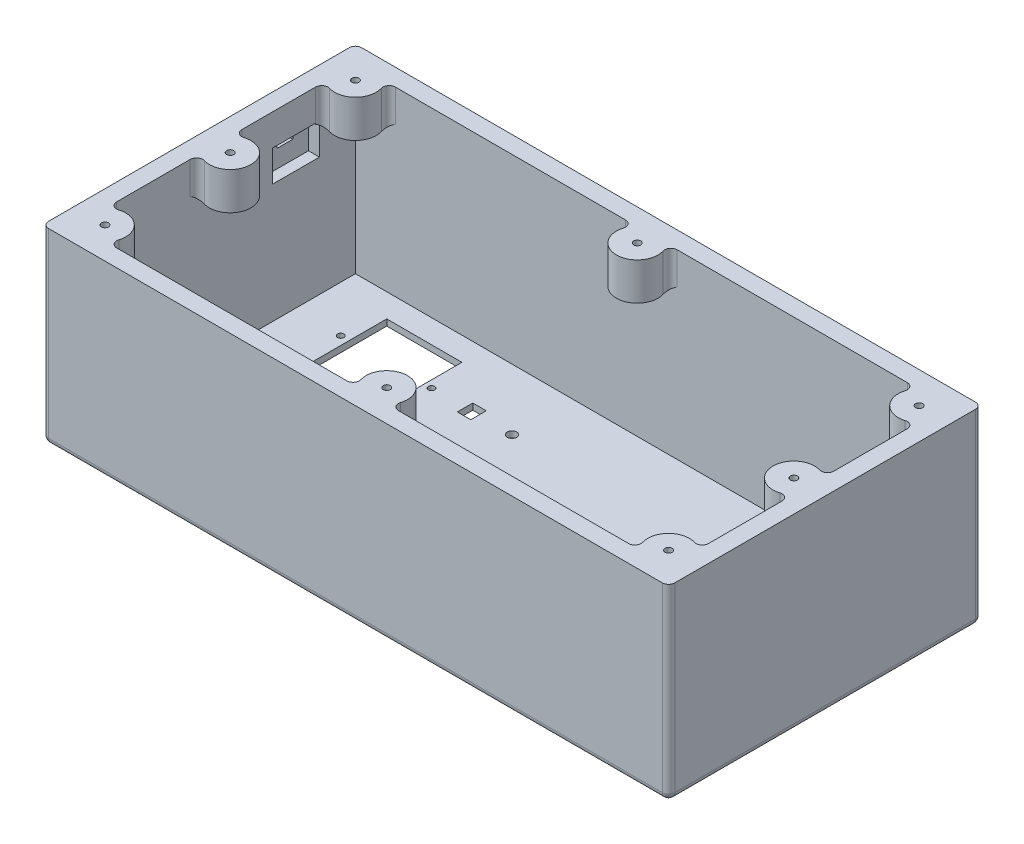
SolidWorks part; units mm, degrees
ref_plane "Front Plane" through (0, 0, 0) normal (0, 0, 1) x (1, 0, 0)
ref_plane "Top Plane" through (0, 0, 0) normal (0, 1, 0) x (1, 0, 0)
ref_plane "Right Plane" through (0, 0, 0) normal (1, 0, 0) x (0, 0, -1)
sketch "Sketch1" plane through (0, 0, 0) normal (0, 1, 0) x (1, 0, 0)
  line L1 (-100, 50) -> (100, 50)
  line L2 (-100, 50) -> (-100, -50)
  line L3 (-100, -50) -> (100, -50)
  line L4 (100, 50) -> (100, -50)
  line L5 (-100, 50) -> (100, -50) construction
  line L6 (-100, -50) -> (100, 50) construction
  point P0 (0, 0)
  dimension "D1" = 200
  dimension "D2" = 100
extrude "Boss-Extrude1" add sketch "Sketch1" along normal blind 60
sketch "Sketch2" plane through (0, 60, 0) normal (0, 1, 0) x (1, 0, 0)
  line L0 (100, 50) -> (-100, 50) construction
  line L1 (-100, 50) -> (-100, -50) construction
  line L2 (100, -50) -> (100, 50) construction
  line L3 (-100, -50) -> (100, -50) construction
  point P0 (-90, 40)
  point P1 (-90, 0)
  point P2 (-90, -40)
  point P3 (0, 40)
  point P4 (90, 40)
  point P5 (90, 0)
  point P6 (90, -40)
  point P7 (0, -40)
hole_wizard "#4-40 Tapped Hole1" positions "Sketch3" profile "Sketch4" tap size "#4-40" standard "ANSI Inch"
sketch "Sketch3" plane through (0, 60, 0) normal (0, 1, 0) x (1, 0, 0)
  point P0 (-90, 40)
  point P4 (-90, 0)
  point P7 (-90, -40)
  point P10 (0, -40)
  point P13 (90, -40)
  point P16 (90, 0)
  point P19 (90, 40)
  point P22 (0, 40)
sketch "Sketch4" plane through (-90, 60, -40) normal (1, 0, 0) x (0, 0, 1)
  line L0 (0, 0) -> (0, 9.5492)
  line L1 (0, 9.5492) -> (1.1303, 8.87)
  line L2 (1.1303, 8.87) -> (1.1303, 0)
  line L5 (1.1303, 0) -> (0, 0)
  line L10 (0, 9.5492) -> (-1.1303, 8.87) construction
  line L11 (0, -6.35) -> (0, 107.95) construction
  dimension "Tap Drill Dia." = 2.2606
  dimension "Tap Drill Depth" = 8.87
  dimension "Drill Angle" = 118
shell "Shell5" thickness 5.5
fillet "Fillet2" radius 2 16 edges at (94.5, 54.0091, -35.1306) (85.1306, 54.0091, -44.5) (4.8694, 54.0091, -44.5) (-4.8694, 54.0091, -44.5) (-85.1306, 54.0091, -44.5) (-94.5, 54.0091, -35.1306) (-94.5, 54.0091, -4.8694) (-94.5, 54.0091, 4.8694) (-94.5, 54.0091, 35.1306) (-85.1306, 54.0091, 44.5) (-4.8694, 54.0091, 44.5) (4.8694, 54.0091, 44.5) (85.1306, 54.0091, 44.5) (94.5, 54.0091, 35.1306) (94.5, 54.0091, 4.8694) (94.5, 54.0091, -4.8694)
sketch "Sketch5" plane through (0, 0, 0) normal (0, -1, 0) x (1, 0, 0)
  line L0 (-100, -50) -> (-100, 50) construction
  line L1 (100, -50) -> (-100, -50) construction
  circle A0 centre (-79.7, -25) radius 1
  dimension "D3" = 2
  dimension "D1" = 20.3
  dimension "D2" = 25
extrude "Cut-Extrude1" cut sketch "Sketch5" against normal blind 5 contours A0
sketch "Sketch6" plane through (0, 0, 0) normal (0, -1, 0) x (1, 0, 0)
  line L0 (100, -50) -> (-100, -50) construction
  line L1 (-77, -13) -> (-53, -13)
  line L2 (-77, -13) -> (-77, -37)
  line L3 (-77, -37) -> (-53, -37)
  line L4 (-53, -13) -> (-53, -37)
  line L5 (-77, -13) -> (-53, -37) construction
  line L6 (-77, -37) -> (-53, -13) construction
  line L7 (-100, -50) -> (-100, 50) construction
  point P0 (-65, -25)
  dimension "D1" = 24
  dimension "D2" = 24
  dimension "D3" = 25
  dimension "D4" = 23
extrude "Cut-Extrude3" cut sketch "Sketch6" against normal blind 5 contours L2 L1 L4 L3
sketch "Sketch7" plane through (0, 0, 0) normal (0, -1, 0) x (1, 0, 0)
  line L0 (-100, -50) -> (-100, 50) construction
  line L1 (100, -50) -> (-100, -50) construction
  circle A0 centre (-50.7, -25) radius 1
  dimension "D3" = 2
  dimension "D1" = 49.3
  dimension "D2" = 25
extrude "Cut-Extrude4" cut sketch "Sketch7" against normal blind 5 contours A0
sketch "Sketch8" plane through (0, 0, 0) normal (0, -1, 0) x (1, 0, 0)
  line L1 (-40, -22.525) -> (-35.7, -22.525)
  line L2 (-40, -22.525) -> (-40, -27.475)
  line L3 (-40, -27.475) -> (-35.7, -27.475)
  line L4 (-35.7, -22.525) -> (-35.7, -27.475)
  line L5 (-40, -22.525) -> (-35.7, -27.475) construction
  line L6 (-40, -27.475) -> (-35.7, -22.525) construction
  line L7 (-100, -50) -> (-100, 50) construction
  line L8 (100, -50) -> (-100, -50) construction
  point P0 (-37.85, -25)
  point P7 (-40, -25)
  point P10 (-100, 0)
  dimension "D1" = 4.3
  dimension "D2" = 4.95
  dimension "D3" = 60
  dimension "D4" = 25
extrude "Cut-Extrude5" cut sketch "Sketch8" against normal blind 5 contours L2 L1 L4 L3
sketch "Sketch9" plane through (0, 0, 0) normal (0, -1, 0) x (1, 0, 0)
  line L0 (-100, -50) -> (-100, 50) construction
  line L1 (100, -50) -> (-100, -50) construction
  circle A0 centre (-25, -25) radius 1.5
  dimension "D3" = 3
  dimension "D1" = 75
  dimension "D2" = 25
extrude "Cut-Extrude6" cut sketch "Sketch9" against normal blind 5 contours A0
sketch "Sketch10" plane through (-100, 0, 0) normal (-1, 0, 0) x (0, 0, 1)
  line L0 (-50, 60) -> (-50, 0) construction
  line L1 (-28, 50) -> (-23, 50)
  line L2 (-28, 50) -> (-28, 45.7)
  line L3 (-28, 45.7) -> (-23, 45.7)
  line L4 (-23, 50) -> (-23, 45.7)
  line L5 (-28, 50) -> (-23, 45.7) construction
  line L6 (-28, 45.7) -> (-23, 50) construction
  line L7 (-50, 60) -> (50, 60) construction
  point P0 (-25.5, 47.85)
  point P5 (-28, 47.85)
  dimension "D1" = 5
  dimension "D2" = 4.3
  dimension "D3" = 22
  dimension "D4" = 10
extrude "Cut-Extrude7" cut sketch "Sketch10" against normal blind 2
sketch "Sketch11" plane through (-94.5, 0, 0) normal (1, 0, 0) x (0, 0, -1)
  line L0 (-50, 60) -> (50, 60) construction
  line L1 (18, 50) -> (33, 50)
  line L2 (18, 50) -> (18, 40)
  line L3 (18, 40) -> (33, 40)
  line L4 (33, 50) -> (33, 40)
  line L5 (18, 50) -> (33, 40) construction
  line L6 (18, 40) -> (33, 50) construction
  line L7 (50, 60) -> (50, 0) construction
  point P0 (25.5, 45)
  dimension "D1" = 15
  dimension "D2" = 10
  dimension "D3" = 10
  dimension "D4" = 17
extrude "Cut-Extrude8" cut sketch "Sketch11" against normal blind 3.5
sketch "Sketch13" plane through (0, 0, 0) normal (0, -1, 0) x (1, 0, 0)
  line L0 (100, 50) -> (100, -50) construction
  circle A0 centre (60, 0) radius 5
  dimension "D1" = 10
  dimension "D2" = 40
extrude "Cut-Extrude9" cut sketch "Sketch13" against normal blind 5 contours A0
sketch "Sketch15" plane through (0, 0, 0) normal (0, -1, 0) x (1, 0, 0)
  line L0 (100, 50) -> (100, -50) construction
  point P0 (72.5, 0)
  point P1 (47.5, 0)
  point P4 (100, 0)
  dimension "D1" = 25
  dimension "D2" = 27.5
hole_wizard "Ø2.0mm Dowel Hole1" positions "Sketch16" profile "Sketch17" hole size "Ø2.0" standard "ANSI Metric"
sketch "Sketch16" plane through (0, 0, 0) normal (0, -1, 0) x (-1, 0, 0)
  point P0 (-47.5, 0)
  point P3 (-72.5, 0)
sketch "Sketch17" plane through (47.5, 0, 0) normal (1, 0, 0) x (0, 0, -1)
  line L0 (0, 0) -> (0, 14.6009)
  line L1 (0, 14.6009) -> (1, 14)
  line L2 (1, 14) -> (1, 0)
  line L5 (1, 0) -> (0, 0)
  line L10 (0, 14.6009) -> (-1, 14) construction
  line L11 (0, -6.35) -> (0, 107.95) construction
  dimension "Hole Dia." = 2
  dimension "Hole Depth" = 14
  dimension "Drill Angle" = 118
sketch "Sketch18" plane through (0, 2, 0) normal (0, 1, 0) x (1, 0, 0)
  line L1 (-100, 50) -> (-100, -50) construction
  circle A0 centre (-75, -35) radius 2
  circle A2 centre (68.773, 26.056) radius 2
  circle A3 centre (68.773, -35) radius 2
  dimension "D1" = 4
  dimension "D3" = 4
  dimension "D4" = 4
  dimension "D6" = 143.773
  dimension "D7" = 25
extrude "Boss-Extrude2" add sketch "Sketch18" along normal blind 20
hole_wizard "CSK for M2 Flat Head Machine Screw4" positions "Sketch32" profile "Sketch33" countersink size "M2" standard "ANSI Metric"
sketch "Sketch32" plane through (0, 22, 0) normal (0, 1, 0) x (1, 0, 0)
  point P0 (68.773, 26.056)
  point P3 (68.773, -35)
  point P6 (-75, -35)
sketch "Sketch33" plane through (68.773, 22, -26.056) normal (1, 0, 0) x (0, 0, 1)
  line L0 (0, 0) -> (0, 14.721)
  line L1 (0, 14.721) -> (1.2, 14)
  line L2 (1.2, 14) -> (1.2, 1)
  line L3 (1.2, 1) -> (2.2, 0)
  line L5 (2.2, 0) -> (0, 0)
  line L6 (-1.2, 1) -> (-2.2, 0) construction
  line L10 (0, 14.721) -> (-1.2, 14) construction
  line L11 (0, -6.35) -> (0, 107.95) construction
  dimension "Hole Dia." = 2.4
  dimension "Hole Depth" = 14
  dimension "Near C'Sink Dia." = 4.4
  dimension "Near C'Sink Angle" = 90
  dimension "Drill Angle" = 118
fillet "Fillet5" radius 2 4 edges at (-100, 30, 50) (-100, 30, -50) (100, 30, -50) (100, 30, 50)
fillet "Fillet6" radius 2 8 edges at (99.4142, 0, 49.4142) (100, 0, 0) (99.4142, 0, -49.4142) (0, 0, -50) (-99.4142, 0, -49.4142) (-100, 0, 0) (-99.4142, 0, 49.4142) (0, 0, 50)
equation "\"D2@Sketch2\"=\"D1@Sketch2\""
equation "\"D3@Sketch2\"=\"D1@Sketch2\""
equation "\"D4@Sketch2\"=\"D1@Sketch2\""
